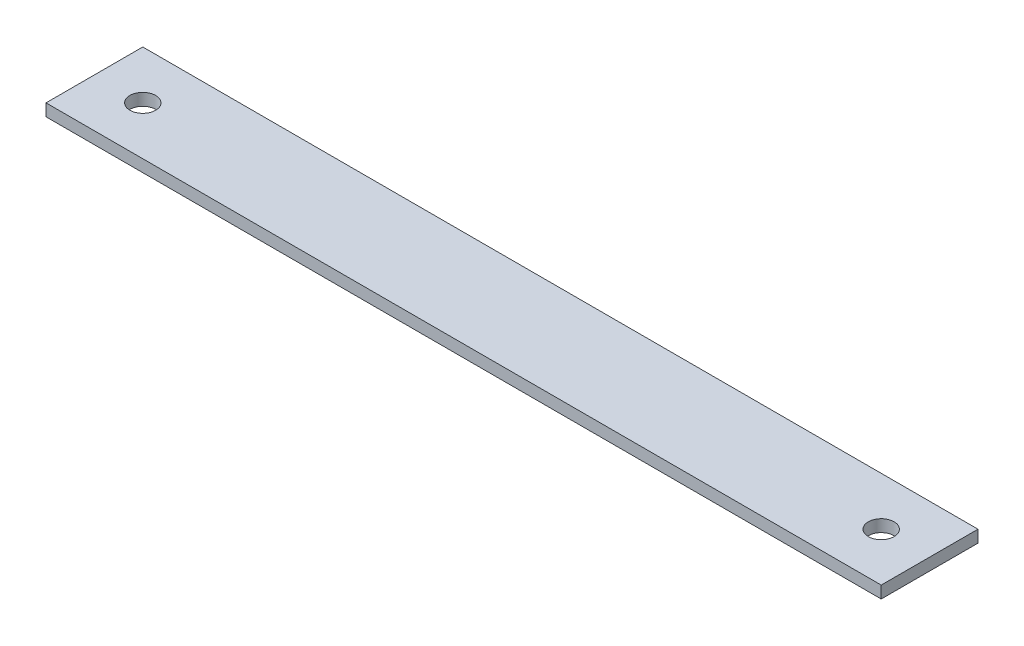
SolidWorks part; units mm, degrees
ref_plane "Front Plane" through (0, 0, 0) normal (0, 0, 1) x (1, 0, 0)
ref_plane "Top Plane" through (0, 0, 0) normal (0, 1, 0) x (1, 0, 0)
ref_plane "Right Plane" through (0, 0, 0) normal (1, 0, 0) x (0, 0, -1)
sketch "Sketch1" plane through (0, 0, 0) normal (0, 1, 0) x (1, 0, 0)
  line L1 (-109.601, 12.7) -> (109.601, 12.7)
  line L2 (-109.601, 12.7) -> (-109.601, -12.7)
  line L3 (-109.601, -12.7) -> (109.601, -12.7)
  line L4 (109.601, 12.7) -> (109.601, -12.7)
  line L5 (-109.601, 12.7) -> (109.601, -12.7) construction
  line L6 (-109.601, -12.7) -> (109.601, 12.7) construction
  point P0 (0, 0)
  dimension "D1" = 219.202
  dimension "D2" = 25.4
extrude "Boss-Extrude1" add sketch "Sketch1" along normal blind 3.175
sketch "Sketch3" plane through (0, 3.175, 0) normal (0, 1, 0) x (1, 0, 0)
  line L0 (-109.601, 0) -> (109.601, 0) construction
  line L1 (-109.601, 12.7) -> (-109.601, -12.7) construction
  line L2 (109.601, -12.7) -> (109.601, 12.7) construction
  line L3 (-109.601, -12.7) -> (109.601, -12.7) construction
  line L4 (-109.601, 12.7) -> (-109.601, -12.7) construction
  line L7 (109.601, -12.7) -> (109.601, 12.7) construction
  circle A0 centre (-96.901, 0) radius 3.3782
  circle A2 centre (96.901, 0) radius 3.3782
  dimension "D3" = 6.7564
  dimension "D4" = 6.7564
  dimension "D5" = 12.7
  dimension "D1" = 12.7
  dimension "D6" = 12.7
extrude "Cut-Extrude1" cut sketch "Sketch3" against normal through all
